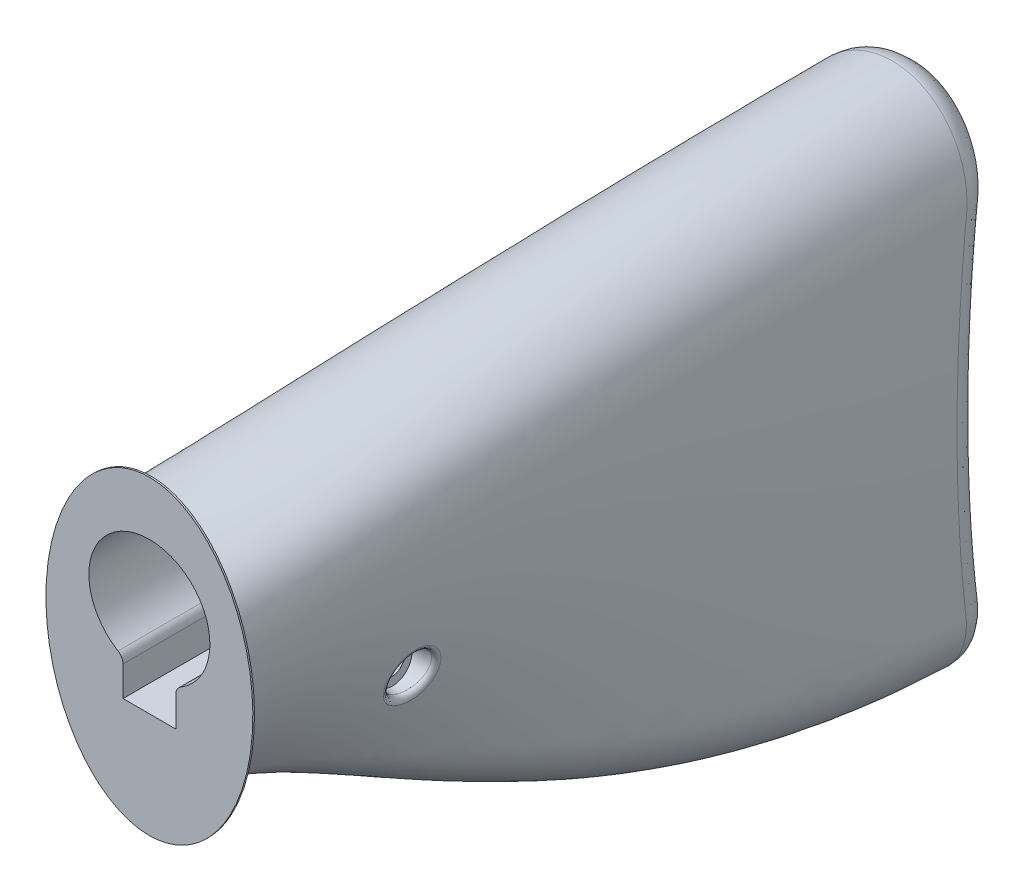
SolidWorks part; units mm, degrees
ref_plane "Front Plane" through (0, 0, 0) normal (0, 0, 1) x (1, 0, 0)
ref_plane "Top Plane" through (0, 0, 0) normal (0, 1, 0) x (1, 0, 0)
ref_plane "Right Plane" through (0, 0, 0) normal (1, 0, 0) x (0, 0, -1)
sketch "Sketch1" plane through (0, 0, 0) normal (0, 0, 1) x (1, 0, 0)
  line L0 (0, 37.2523) -> (0, -28.9777) construction
  line L1 (-22.225, 1.7278) -> (-22.225, 17.909) construction
  arc A0 (-14.2875, 13.501) -> (14.2875, 13.501) centre (0, -21.8186) cw
  arc A1 (-14.2875, 13.501) -> (-22.225, 1.7278) centre (-9.525, 1.7278) ccw
  arc A2 (14.2875, 13.501) -> (22.225, 1.7278) centre (9.525, 1.7278) cw
  arc A3 (-9.9123, -33.3395) -> (9.9123, -33.3395) centre (0, -25.4) ccw
  arc A4 (-22.225, 1.7278) -> (-9.9123, -33.3395) centre (33.8684, 1.7278) ccw
  arc A5 (22.225, 1.7278) -> (9.9123, -33.3395) centre (-33.8684, 1.7278) cw
  dimension "D1" = 12.7
  dimension "D2" = 38.1
  dimension "D3" = 25.4
  dimension "D4" = 44.45
  dimension "D5" = 21.8186
ref_plane "Plane1" through (0, 0, -190.5) normal (0, 0, -1) x (-1, 0, 0)
sketch "Sketch2" plane through (0, 0, -190.5) normal (0, 0, -1) x (-1, 0, 0)
  line L0 (0, 200037.2523) -> (0, -200028.9777) construction
  line L1 (0, 25.4) -> (0, -101.6) construction
  line L2 (-22.225, -38.1) -> (22.225, -38.1) construction
  line L3 (-20.9709, 5.5991) -> (-20.9709, -81.7991) construction
  arc A6 (20.9709, 5.5991) -> (14.2875, 19.7925) centre (0, 4.3945) ccw
  arc A7 (20.9709, -81.7991) -> (20.9709, 5.5991) centre (-739.775, -38.1) ccw
  arc A8 (-20.9709, -81.7991) -> (20.9709, -81.7991) centre (0, -80.5945) ccw
  arc A9 (-20.9709, 5.5991) -> (-20.9709, -81.7991) centre (739.775, -38.1) ccw
  arc A10 (-14.2875, 19.7925) -> (-20.9709, 5.5991) centre (0, 4.3945) ccw
  arc A11 (14.2875, 19.7925) -> (-14.2875, 19.7925) centre (0, 4.3945) ccw
  dimension "D1" = 25.4
  dimension "D2" = 762
  dimension "D4" = 127
  dimension "D5" = 44.45
loft "Loft1" add profiles "Sketch1", "Sketch2"
sketch "Sketch3" plane through (0, 0, 0) normal (0, 0, 1) x (1, 0, 0)
  line L0 (-6.477, -13.373) -> (-6.477, -22.225)
  line L1 (-6.477, -22.225) -> (6.477, -22.225)
  line L2 (6.477, -22.225) -> (6.477, -13.373)
  line L3 (0, -22.225) -> (0, 0) construction
  arc A0 (6.477, -13.373) -> (-6.477, -13.373) centre (0, 0) ccw
  point P11 (0, 14.859)
  dimension "D2" = 14.859
  dimension "D3" = 12.954
  dimension "D4" = 37.084
extrude "Cut-Extrude1" cut sketch "Sketch3" against normal blind 91.44
sketch "Sketch4" plane through (0, 0, 0) normal (1, 0, 0) x (0, 0, -1)
  line L1 (91.44, -22.225) -> (0, -22.225) construction
  circle A0 centre (45.72, -22.225) radius 25.4
  dimension "D1" = 50.8
extrude "Cut-Extrude2" cut sketch "Sketch4" against normal mid plane 2.54
sketch "Sketch5" plane through (0, 0, 0) normal (1, 0, 0) x (0, 0, -1)
  line L0 (91.44, -22.225) -> (0, -22.225) construction
  line L1 (47.763, -25.7177) -> (48.895, -27.0667)
  line L2 (48.895, -27.0667) -> (48.895, -27.7973)
  line L3 (48.895, -27.7973) -> (47.763, -29.1463)
  line L4 (45.72, -27.432) -> (48.895, -27.432) construction
  arc A0 (47.763, -25.7177) -> (47.763, -29.1463) centre (45.72, -27.432) ccw
  circle A1 centre (45.72, -27.432) radius 2.667 construction
  circle A2 centre (45.72, -22.225) radius 25.4
  circle A3 centre (45.72, -22.225) radius 25.4 construction
  point P2 (45.72, -24.765)
  point P13 (48.387, -27.432)
  dimension "D1" = 5.334
  dimension "D4" = 0.508
  dimension "D2" = 2.54
  dimension "D5" = 100
  dimension "D3" = 0
extrude "Cut-Extrude3" cut sketch "Sketch5" against normal through all both and the other way through all
ref_plane "Plane2" through (13.97, 0, 0) normal (1, 0, 0) x (0, 0, -1)
ref_plane "Plane3" through (-13.97, 0, 0) normal (-1, 0, 0) x (0, 0, 1)
sketch "Sketch6" plane through (13.97, 0, 0) normal (1, 0, 0) x (0, 0, -1)
  circle A0 centre (45.72, -27.432) radius 4.7625
  dimension "D1" = 9.525
extrude "Cut-Extrude4" cut sketch "Sketch6" along normal through all draft 5
sketch "Sketch7" plane through (-13.97, 0, 0) normal (-1, 0, 0) x (0, 0, 1)
  line L1 (-51.2926, -27.432) -> (-48.5063, -32.258)
  line L2 (-48.5063, -32.258) -> (-42.9337, -32.258)
  line L3 (-42.9337, -32.258) -> (-40.1474, -27.432)
  line L4 (-40.1474, -27.432) -> (-42.9337, -22.606)
  line L5 (-42.9337, -22.606) -> (-48.5063, -22.606)
  line L6 (-48.5063, -22.606) -> (-51.2926, -27.432)
  circle A0 centre (-45.72, -27.432) radius 4.826 construction
  dimension "D1" = 9.652
extrude "Cut-Extrude5" cut sketch "Sketch7" along normal through all draft 5
sketch "Sketch8" plane through (0, 0, 0) normal (1, 0, 0) x (0, 0, -1)
  line L0 (91.44, 14.859) -> (0, 14.859)
  line L1 (91.44, 14.859) -> (0, 14.859) construction
  line L2 (0, 0) -> (91.44, 0) construction
  line L3 (91.44, 14.859) -> (106.299, 0)
  line L4 (106.299, 0) -> (91.44, 0)
  line L5 (91.44, 14.859) -> (91.44, 0)
  dimension "D1" = 45
revolve "Cut-Revolve1" cut sketch "Sketch8" angle 360 about L2
sketch "Sketch9" plane through (0, -22.225, 0) normal (0, 1, 0) x (1, 0, 0)
  line L0 (-6.477, 91.44) -> (6.477, 91.44)
  line L1 (6.477, 91.44) -> (0, 97.917)
  line L2 (0, 97.917) -> (-6.477, 91.44)
  dimension "D1" = 90
extrude "Cut-Extrude6" cut sketch "Sketch9" along normal up to next
fillet "Fillet1" radius 1.27 7 edges at (18.8469, -26.0777, -40.7107)
fillet "Fillet2" radius 1.27 2 edges at (1.27, -47.625, -45.72) (-1.27, -47.625, -45.72)
fillet "Fillet3" radius 1.27 6 edges at (0.898, -22.225, -70.748) (0.898, -22.225, -20.692) (-0.898, -22.225, -70.748) (-0.898, -22.225, -20.692) (-1.27, -22.225, -45.72) (1.27, -22.225, -45.72)
fillet "Fillet4" radius 2.54 3 edges at (6.477, -17.799, -91.44) (0, 14.859, -91.44) (-6.477, -17.799, -91.44)
fillet "Fillet5" radius 2.54 6 edges at (-6.477, -13.373, -45.1939) (-6.1935, -13.1942, -91.554) (6.1935, -13.1942, -91.554) (6.477, -13.373, -45.1939)
sketch "Sketch14" plane through (0, 0, 0) normal (1, 0, 0) x (0, 0, -1)
  circle A0 centre (436.4342, -38.1002) radius 254
  dimension "D1" = 508
extrude "Cut-Extrude7" cut sketch "Sketch14" against normal through all both and the other way through all
fillet "Fillet6" radius 6.35 1 edges at (-21.0203, -80.7661, -186.0433)
sketch "Sketch13" plane through (0, 0, 0) normal (0, 0, 1) x (1, 0, 0)
  line L4 (-6.477, -13.373) -> (-6.477, -22.225)
  line L5 (-6.477, -22.225) -> (6.477, -22.225)
  line L6 (6.477, -22.225) -> (6.477, -13.373)
  line L7 (-6.477, -14.8802) -> (-6.477, -22.225)
  line L8 (-6.477, -22.225) -> (6.477, -22.225)
  line L9 (6.477, -22.225) -> (6.477, -14.8802)
  arc A0 (6.477, -14.8802) -> (7.7006, -12.7079) centre (9.017, -14.8802) cw
  arc A1 (6.477, -13.373) -> (-6.477, -13.373) centre (0, 0) ccw
  arc A2 (7.7006, -12.7079) -> (-7.7006, -12.7079) centre (0, 0) ccw
  arc A3 (-6.477, -14.8802) -> (-7.7006, -12.7079) centre (-9.017, -14.8802) ccw
  ellipse E0 centre (0, -10.0183) end of major axis (0, -48.1183) minor radius 25.4
  dimension "D2" = 2.54
  dimension "D3" = 76.2
  dimension "D4" = 50.8
  dimension "D1" = 0
extrude "Boss-Extrude2" add sketch "Sketch13" against normal blind 0.4064
